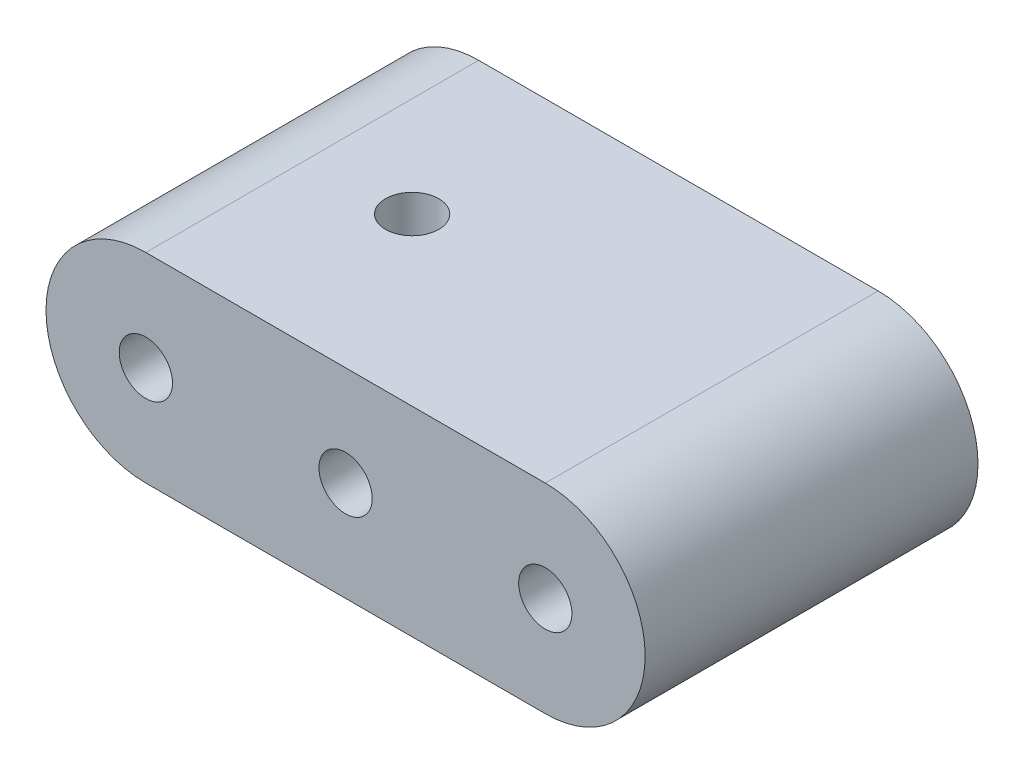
SolidWorks part; units mm, degrees
ref_plane "Ön Düzlem" through (0, 0, 0) normal (0, 0, 1) x (1, 0, 0)
ref_plane "Üst Düzlem" through (0, 0, 0) normal (0, 1, 0) x (1, 0, 0)
ref_plane "Sağ Düzlem" through (0, 0, 0) normal (1, 0, 0) x (0, 0, -1)
sketch "Çizim1" plane through (0, 0, 0) normal (0, 0, 1) x (1, 0, 0)
  line L0 (-30, 0) -> (30, 0) construction
  line L1 (-30, 15) -> (30, 15)
  line L2 (-30, -15) -> (30, -15)
  arc A0 (-30, 15) -> (-30, -15) centre (-30, 0) ccw
  arc A1 (30, -15) -> (30, 15) centre (30, 0) ccw
  point P3 (0, 0)
  dimension "D1" = 15
  dimension "D2" = 0
  dimension "D3" = 60
extrude "Yükseklik-Ekstrüzyon1" add sketch "Çizim1" along normal blind 50
sketch "Çizim2" plane through (0, 0, 50) normal (0, 0, 1) x (1, 0, 0)
  circle A0 centre (-30, 0) radius 4
  circle A1 centre (0, 0) radius 4
  circle A2 centre (30, 0) radius 4
  dimension "D1" = 30
  dimension "D2" = 8
  dimension "D3" = 3
extrude "Kes-Ekstrüzyon1" cut sketch "Çizim2" against normal blind 6
sketch "Çizim3" plane through (0, 0, 0) normal (0, 0, -1) x (-1, 0, 0)
  circle A0 centre (-30, 0) radius 4
  circle A1 centre (0, 0) radius 4
  circle A2 centre (30, 0) radius 4
  dimension "D1" = 8
  dimension "D2" = 30
  dimension "D3" = 3
extrude "Kes-Ekstrüzyon2" cut sketch "Çizim3" against normal blind 6
sketch "Çizim4" plane through (0, 15, 0) normal (0, 1, 0) x (1, 0, 0)
  line L0 (30, 0) -> (-30, 0) construction
  circle A0 centre (-15, -25) radius 4
  dimension "D1" = 25
  dimension "D2" = 15
  dimension "D3" = 8
extrude "Kes-Ekstrüzyon3" cut sketch "Çizim4" against normal blind 6
ref_plane "Düzlem1" through (0, 0, 10) normal (0, 0, -1) x (-1, 0, 0)
sketch "Çizim5" plane through (0, 0, 10) normal (0, 0, -1) x (-1, 0, 0)
  line L0 (-30, 15) -> (30, 15) construction
  line L1 (-21.3397, 5) -> (21.3397, 5)
  line L3 (-21.3397, -5) -> (21.3397, -5)
  line L5 (30, -15) -> (-30, -15) construction
  arc A2 (21.3397, -5) -> (21.3397, 5) centre (30, 0) ccw
  arc A3 (-21.3397, 5) -> (-21.3397, -5) centre (-30, 0) ccw
  dimension "D5" = 20
  dimension "D6" = 20
  dimension "D1" = 10
  dimension "D2" = 10
extrude "Kes-Ekstrüzyon4" cut sketch "Çizim5" against normal blind 30
